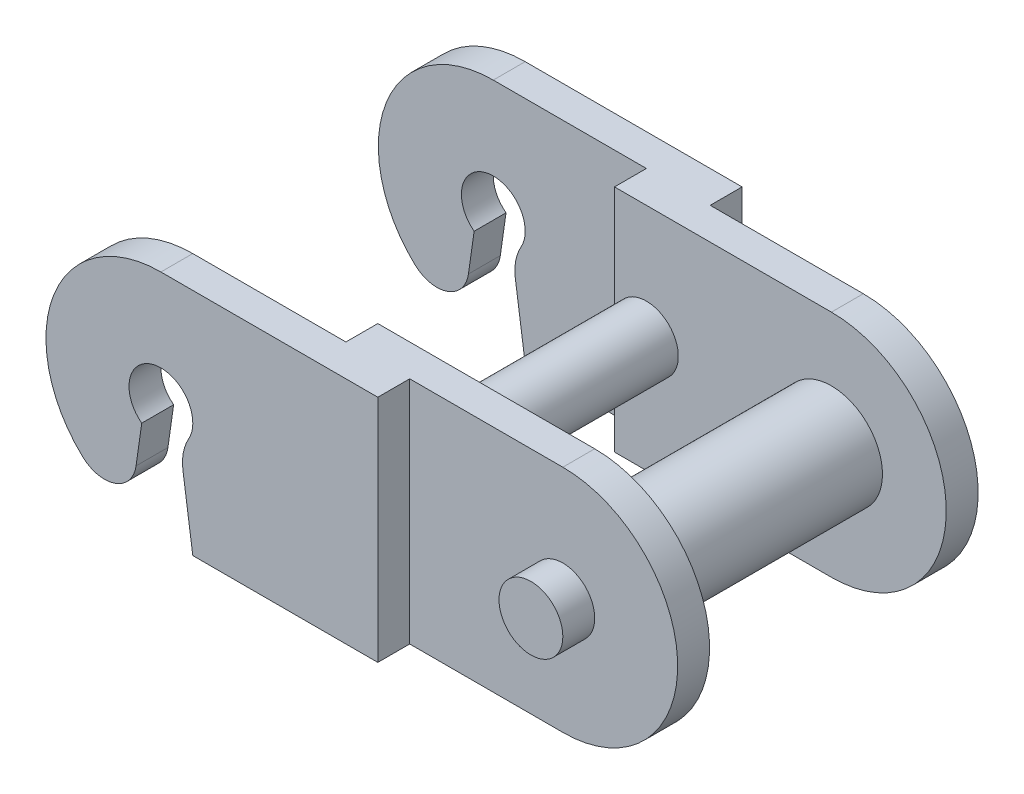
SolidWorks part; units mm, degrees
ref_plane "정면" through (0, 0, 0) normal (0, 0, 1) x (1, 0, 0)
ref_plane "윗면" through (0, 0, 0) normal (0, 1, 0) x (1, 0, 0)
ref_plane "우측면" through (0, 0, 0) normal (1, 0, 0) x (0, 0, -1)
sketch "스케치1" plane through (0, 0, 0) normal (0, 0, 1) x (1, 0, 0)
  line L0 (0, 0) -> (2.9, 0) construction
  circle A0 centre (0, 0) radius 0.5
  circle A1 centre (2.9, 0) radius 0.8
  dimension "D1" = 2.9
  dimension "D2" = 1.6
  dimension "D3" = 1
extrude "보스-돌출1" add sketch "스케치1" along normal mid plane 3.71
sketch "스케치2" plane through (0, 0, 1.855) normal (0, 0, 1) x (1, 0, 0)
  line L1 (-0.5, -1.8) -> (2.9, -1.8)
  line L2 (-2.7957, -1.8) -> (-0.5, -1.8)
  line L3 (-2.9, 1.8) -> (2.9, 1.8)
  circle A2 centre (2.9, 0) radius 0.8 construction
  arc A3 (2.9, 1.8) -> (2.9, -1.8) centre (2.9, 0) cw
  arc A6 (-2.9, 1.8) -> (-2.7957, -1.8) centre (-2.9, -0.0015) ccw
  point P6 (2.9, 0)
  point P7 (2.9, 0.8)
  point P11 (2.9, -0.8)
  dimension "D3" = 1.8
  dimension "D6" = 1.8015
  dimension "D1" = 1
  dimension "D2" = 1
  dimension "D4" = 3.4
  dimension "D5" = 5.8
extrude "보스-돌출2" add sketch "스케치2" along normal blind 1 contours L3 A3 L1 L2 A6
sketch "스케치3" plane through (0, 0, 1.855) normal (0, 0, -1) x (-1, 0, 0)
  line L0 (2.9, 1.8) -> (-2.9, 1.8) construction
  line L1 (-0.5, 1.8) -> (-7.634, 1.8)
  line L2 (-0.5, 1.8) -> (-0.5, -1.8)
  line L3 (-0.5, -1.8) -> (-7.634, -1.8)
  line L4 (-7.634, 1.8) -> (-7.634, -1.8)
  line L5 (2.7957, -1.8) -> (-2.9, -1.8) construction
  circle A0 centre (-2.9, 0) radius 0.5
  circle A1 centre (0, 0) radius 0.5 construction
  dimension "D1" = 7.134
extrude "컷-돌출1" cut sketch "스케치3" against normal blind 1 from offset 0.5
sketch "스케치4" plane through (0, 0, 1.855) normal (0, 0, -1) x (-1, 0, 0)
  line L0 (2.9, 1.8) -> (-2.9, 1.8) construction
  line L1 (0.5, 1.8) -> (6.1916, 1.8)
  line L2 (0.5, 1.8) -> (0.5, -1.8)
  line L3 (0.5, -1.8) -> (6.1916, -1.8)
  line L4 (6.1916, 1.8) -> (6.1916, -1.8)
  line L5 (2.7957, -1.8) -> (-2.9, -1.8) construction
  circle A0 centre (0, 0) radius 0.5 construction
  dimension "D1" = 5.6916
extrude "컷-돌출2" cut sketch "스케치4" against normal blind 0.5
sketch "스케치5" plane through (0, 0, 2.355) normal (0, 0, -1) x (-1, 0, 0)
  line L0 (2.9, 0.8669) -> (2.9, -2.5144) construction
  line L1 (2.6, -0.4015) -> (2.4, -1.8)
  line L2 (0.5, -1.8) -> (2.7957, -1.8) construction
  line L3 (3.2, -0.4015) -> (3.4, -1.8)
  line L5 (2.4, -1.8) -> (2.4, -2.0753)
  line L6 (2.4, -2.0753) -> (3.4, -2.0753)
  line L7 (3.4, -2.0753) -> (3.4, -1.8)
  arc A0 (3.2, -0.4015) -> (2.6, -0.4015) centre (2.9, -0.0015) ccw
  circle A1 centre (0, 0) radius 0.5 construction
  dimension "D1" = 0.5
  dimension "D2" = 0.4
  dimension "D3" = 0.2753
extrude "컷-돌출3" cut sketch "스케치5" against normal through all both and the other way through all contours A0 L1 L5 L6 L7 L3
fillet "필렛2" radius 0.5 1 edges at (-3.3907, -1.7349, 2.605)
fillet "필렛3" radius 0.75 1 edges at (-2.6, -0.4015, 2.605)
mirror "대칭 복사1" about plane through (0, 0, 0) normal (0, 0, 1) of "필렛2", "컷-돌출3", "컷-돌출2", "컷-돌출1", "보스-돌출2", "필렛3"
